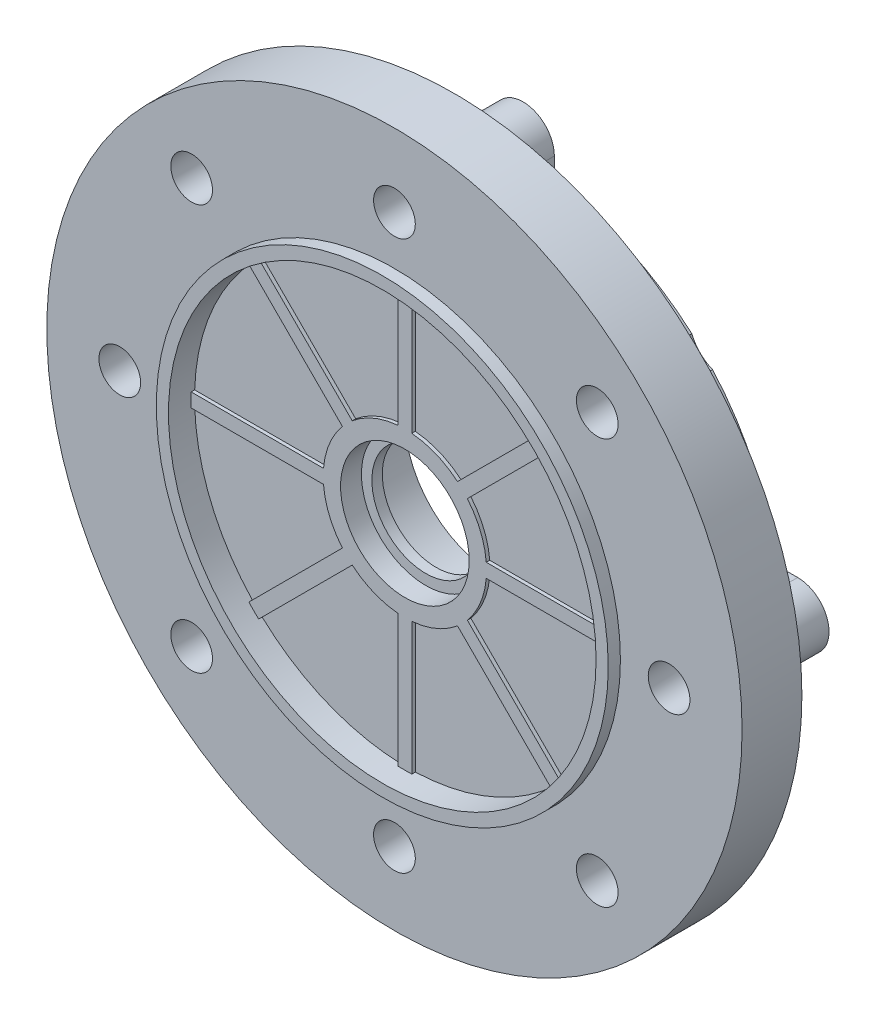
SolidWorks part; units mm, degrees
ref_plane "前视基准面" through (0, 0, 0) normal (0, 0, 1) x (1, 0, 0)
ref_plane "上视基准面" through (0, 0, 0) normal (0, 1, 0) x (1, 0, 0)
ref_plane "右视基准面" through (0, 0, 0) normal (1, 0, 0) x (0, 0, -1)
sketch "草图1" plane through (0, 0, 0) normal (0, 1, 0) x (1, 0, 0)
  line L0 (0, 0) -> (0, 80.2074) construction
  line L1 (15.5, 5.829) -> (22.5, 5.829)
  line L2 (22.5, 5.829) -> (22.5, 6.829)
  line L3 (22.5, 6.829) -> (26, 6.829)
  line L4 (26, 6.829) -> (26, 22.829)
  line L5 (26, 22.829) -> (34, 22.829)
  line L6 (34, 22.829) -> (34, 7.329)
  line L7 (15.5, 5.829) -> (15.5, 2.829)
  line L8 (15.5, 2.829) -> (18.5, 2.829)
  line L9 (18.5, 2.829) -> (18.5, -3.171)
  line L10 (18.5, -3.171) -> (23.5, -3.171)
  line L11 (23.5, -3.171) -> (23.5, -2.171)
  line L12 (23.5, -2.171) -> (61.5, -2.171)
  line L13 (61.5, -2.171) -> (61.5, -9.671)
  line L14 (61.5, -9.671) -> (65, -9.671)
  line L15 (65, -9.671) -> (65, -6.171)
  line L16 (65, -6.171) -> (100, -6.171)
  line L17 (100, -6.171) -> (100, 11.0373)
  line L18 (100, 11.0373) -> (73, 11.0373)
  line L19 (73, 11.0373) -> (73, 30.829)
  line L20 (73, 30.829) -> (69, 30.829)
  line L21 (69, 30.829) -> (69, 7.329)
  line L22 (39, 2.329) -> (64, 2.329)
  arc A0 (69, 7.329) -> (64, 2.329) centre (64, 7.329) cw
  arc A1 (39, 2.329) -> (34, 7.329) centre (39, 7.329) cw
  dimension "D8" = 18.5
  dimension "D20" = 5
  dimension "D1" = 15.5
  dimension "D2" = 22.5
  dimension "D3" = 26
  dimension "D4" = 1
  dimension "D5" = 16
  dimension "D6" = 34
  dimension "D7" = 6
  dimension "D9" = 23.5
  dimension "D10" = 1
  dimension "D11" = 61.5
  dimension "D12" = 65
  dimension "D13" = 100
  dimension "D14" = 3.5
  dimension "D15" = 7.5
  dimension "D16" = 69
  dimension "D17" = 37
  dimension "D18" = 73
  dimension "D19" = 4.5
  dimension "D21" = 24
revolve "旋转1" add sketch "草图1" angle 360 about L0
sketch "草图2" plane through (0, 0, -30.829) normal (0, 0, -1) x (-1, 0, 0)
  circle A0 centre (0, 0) radius 70
extrude "切除-拉伸1" cut sketch "草图2" against normal blind 4
sketch "草图3" plane through (0, 0, -30.829) normal (0, 0, -1) x (-1, 0, 0)
  line L1 (9, 75.553) -> (9, 91.214)
  line L4 (47.0601, 59.788) -> (58.1341, 70.862)
  arc A3 (57.8393, 75.3632) -> (12.3913, 94.1884) centre (0, 0) ccw
  arc A4 (43.1764, 59.4815) -> (11.5294, 72.5901) centre (0, 0) ccw
  arc A5 (9, 91.214) -> (12.3913, 94.1884) centre (12, 91.214) cw
  arc A6 (58.1341, 70.862) -> (57.8393, 75.3632) centre (56.0128, 72.9833) ccw
  arc A7 (47.0601, 59.788) -> (43.1764, 59.4815) centre (44.9387, 61.9093) cw
  arc A8 (11.5294, 72.5901) -> (9, 75.553) centre (12, 75.553) cw
  point P57 (0, 0)
  dimension "D1" = 3
extrude "切除-拉伸5" cut sketch "草图3" against normal blind 33
pattern_circular "阵列(圆周)1" count 8 over 360 about axis through (0, 0, 0) along (0, 0, 1) of "切除-拉伸5"
sketch "草图4" plane through (0, 0, -5.829) normal (0, 0, -1) x (-1, 0, 0)
  line L0 (-9, 79) -> (-9, 75.553)
  line L1 (9, 79) -> (9, 75.553)
  arc A2 (-11.5294, 72.5901) -> (-9, 75.553) centre (-12, 75.553) ccw
  arc A5 (11.5294, 72.5901) -> (9, 75.553) centre (12, 75.553) cw
  arc A6 (11.5294, 72.5901) -> (-11.5294, 72.5901) centre (0, 0) ccw
  arc A29 (9, 79) -> (-9, 79) centre (0, 79) ccw
  dimension "D1" = 3
  dimension "D2" = 3
extrude "凸台-拉伸1" add sketch "草图4" along normal up to surface (25 mm away)
pattern_circular "阵列(圆周)2" count 4 over 360 about axis through (0, 0, 0) along (0, 0, 1) of "凸台-拉伸1"
sketch "草图11" plane through (0, 0, -11.0373) normal (0, 0, -1) x (-1, 0, 0)
  line L0 (0, 0) -> (0, 82.5) construction
  line L1 (0, 0) -> (-58.3363, 58.3363) construction
  circle A3 centre (-58.3363, 58.3363) radius 6
  circle A4 centre (58.3363, 58.3363) radius 6
  circle A5 centre (58.3363, -58.3363) radius 6
  circle A6 centre (-58.3363, -58.3363) radius 6
  point P14 (0, 0)
  dimension "D1" = 45
  dimension "D2" = 4
extrude "切除-拉伸6" cut sketch "草图11" against normal through all
sketch "草图12" plane through (0, 0, -11.0373) normal (0, 0, -1) x (-1, 0, 0)
  line L0 (0, 0) -> (-58.3363, 58.3363) construction
  circle A1 centre (-58.3363, 58.3363) radius 10.5
extrude "切除-拉伸7" cut sketch "草图12" along normal blind 33
pattern_circular "阵列(圆周)3" count 4 over 360 about axis through (0, 0, 0) along (0, 0, 1) of "切除-拉伸7"
sketch "草图15" plane through (0, 0, -30.829) normal (0, 0, -1) x (-1, 0, 0)
  circle A1 centre (0, 79) radius 3
extrude "切除-拉伸8" cut sketch "草图15" against normal through all
pattern_circular "阵列(圆周)4" count 4 over 360 about axis through (0, 0, 0) along (0, 0, 1) of "切除-拉伸8"
sketch "草图16" plane through (0, 0, 6.171) normal (0, 0, 1) x (1, 0, 0)
  circle A1 centre (0, 79) radius 6
extrude "切除-拉伸9" cut sketch "草图16" against normal blind 29
pattern_circular "阵列(圆周)5" count 4 over 360 about axis through (0, 0, 0) along (0, 0, 1) of "切除-拉伸9"
sketch "草图17" plane through (0, 0, 2.171) normal (0, 0, 1) x (1, 0, 0)
  line L0 (14.6425, 17.4709) -> (17.4709, 14.6425)
  line L1 (17.4709, 14.6425) -> (46.6969, 43.8685)
  line L2 (2, 22.7076) -> (2, 64.0394)
  line L3 (-2, 22.7076) -> (-2, 64.0394)
  line L4 (-2, 64.0394) -> (2, 64.0394)
  line L5 (-2, 22.7076) -> (2, 22.7076)
  line L6 (43.8685, 46.6969) -> (46.6969, 43.8685)
  line L7 (14.6425, 17.4709) -> (43.8685, 46.6969)
  line L8 (22.7076, 2) -> (22.7076, -2)
  line L9 (22.7076, -2) -> (64.0394, -2)
  line L10 (64.0394, 2) -> (64.0394, -2)
  line L11 (22.7076, 2) -> (64.0394, 2)
  line L12 (17.4709, -14.6425) -> (14.6425, -17.4709)
  line L13 (14.6425, -17.4709) -> (43.8685, -46.6969)
  line L14 (46.6969, -43.8685) -> (43.8685, -46.6969)
  line L15 (17.4709, -14.6425) -> (46.6969, -43.8685)
  line L16 (2, -22.7076) -> (-2, -22.7076)
  line L17 (-2, -22.7076) -> (-2, -64.0394)
  line L18 (2, -64.0394) -> (-2, -64.0394)
  line L19 (2, -22.7076) -> (2, -64.0394)
  line L20 (-14.6425, -17.4709) -> (-17.4709, -14.6425)
  line L21 (-17.4709, -14.6425) -> (-46.6969, -43.8685)
  line L22 (-43.8685, -46.6969) -> (-46.6969, -43.8685)
  line L23 (-14.6425, -17.4709) -> (-43.8685, -46.6969)
  line L24 (-22.7076, -2) -> (-22.7076, 2)
  line L25 (-22.7076, 2) -> (-64.0394, 2)
  line L26 (-64.0394, -2) -> (-64.0394, 2)
  line L27 (-22.7076, -2) -> (-64.0394, -2)
  line L28 (-17.4709, 14.6425) -> (-14.6425, 17.4709)
  line L29 (-14.6425, 17.4709) -> (-43.8685, 46.6969)
  line L30 (-46.6969, 43.8685) -> (-43.8685, 46.6969)
  line L31 (-17.4709, 14.6425) -> (-46.6969, 43.8685)
  point P37 (0, 0)
  dimension "D1" = 8
extrude "凸台-拉伸3" add sketch "草图17" along normal up to surface (1 mm away)
sketch "草图18" plane through (0, 0, -2.329) normal (0, 0, -1) x (-1, 0, 0)
  line L2 (2, 32.0221) -> (2, 70.6942)
  line L3 (-2, 32.0221) -> (-2, 70.6942)
  line L4 (-2, 70.6942) -> (2, 70.6942)
  line L5 (-2, 32.0221) -> (2, 32.0221)
extrude "凸台-拉伸4" add sketch "草图18" along normal blind 3
pattern_circular "阵列(圆周)6" count 8 over 360 about axis through (0, 0, 0) along (0, 0, 1) of "凸台-拉伸4"
sketch "草图19" plane through (0, 0, -22.829) normal (0, 0, -1) x (-1, 0, 0)
  circle A2 centre (-29.455, 13.7351) radius 5
extrude "凸台-拉伸5" add sketch "草图19" against normal up to surface (20.5 mm away)
pattern_circular "阵列(圆周)7" count 6 over 360 about axis through (0, 0, 0) along (0, 0, 1) of "凸台-拉伸5"
sketch "草图20" plane through (0, 0, -22.829) normal (0, 0, -1) x (-1, 0, 0)
  circle A0 centre (-29.455, 13.7351) radius 2.05
extrude "切除-拉伸10" cut sketch "草图20" against normal blind 2.05 draft 45
pattern_circular "阵列(圆周)8" count 3 over 360 about axis through (0, 0, 0) along (0, 0, 1) of "切除-拉伸10"
